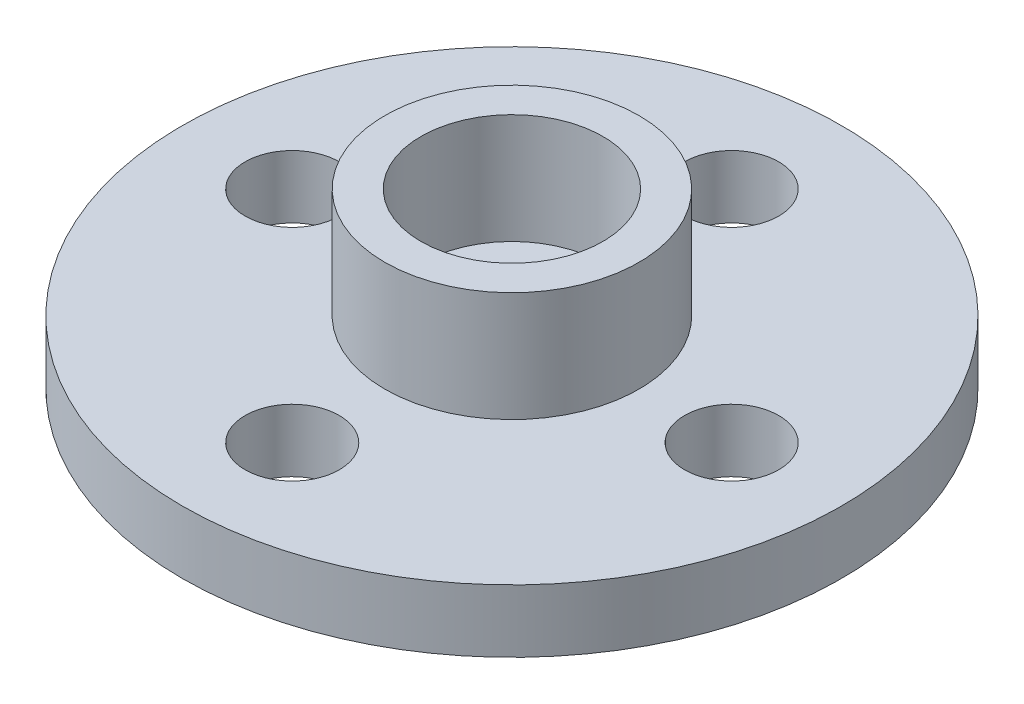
SolidWorks part; units mm, degrees
ref_plane "前视基准面" through (0, 0, 0) normal (0, 0, 1) x (1, 0, 0)
ref_plane "上视基准面" through (0, 0, 0) normal (0, 1, 0) x (1, 0, 0)
ref_plane "右视基准面" through (0, 0, 0) normal (1, 0, 0) x (0, 0, -1)
sketch "草图1" plane through (0, 0, 0) normal (0, 1, 0) x (1, 0, 0)
  circle A0 centre (0, 0) radius 10.5
  circle A1 centre (7, 0) radius 1.5
  circle A2 centre (0, -7) radius 1.5
  circle A3 centre (-7, 0) radius 1.5
  circle A4 centre (0, 7) radius 1.5
  point P14 (0, 0)
  dimension "D1" = 21
  dimension "D2" = 7
  dimension "D3" = 3
  dimension "D4" = 4
extrude "凸台-拉伸1" add sketch "草图1" along normal blind 2
sketch "草图2" plane through (0, 2, 0) normal (0, 1, 0) x (1, 0, 0)
  circle A0 centre (0, 0) radius 4.05
  dimension "D1" = 8.1
extrude "凸台-拉伸2" add sketch "草图2" along normal blind 3.5
sketch "草图3" plane through (0, 5.5, 0) normal (0, 1, 0) x (1, 0, 0)
  circle A0 centre (0, 0) radius 2.9
  dimension "D1" = 5.8
extrude "切除-拉伸1" cut sketch "草图3" against normal blind 3.5
sketch "草图4" plane through (0, 2, 0) normal (0, 1, 0) x (1, 0, 0)
  circle A0 centre (0, 0) radius 1.5
extrude "切除-拉伸2" cut sketch "草图4" against normal blind 3.5
